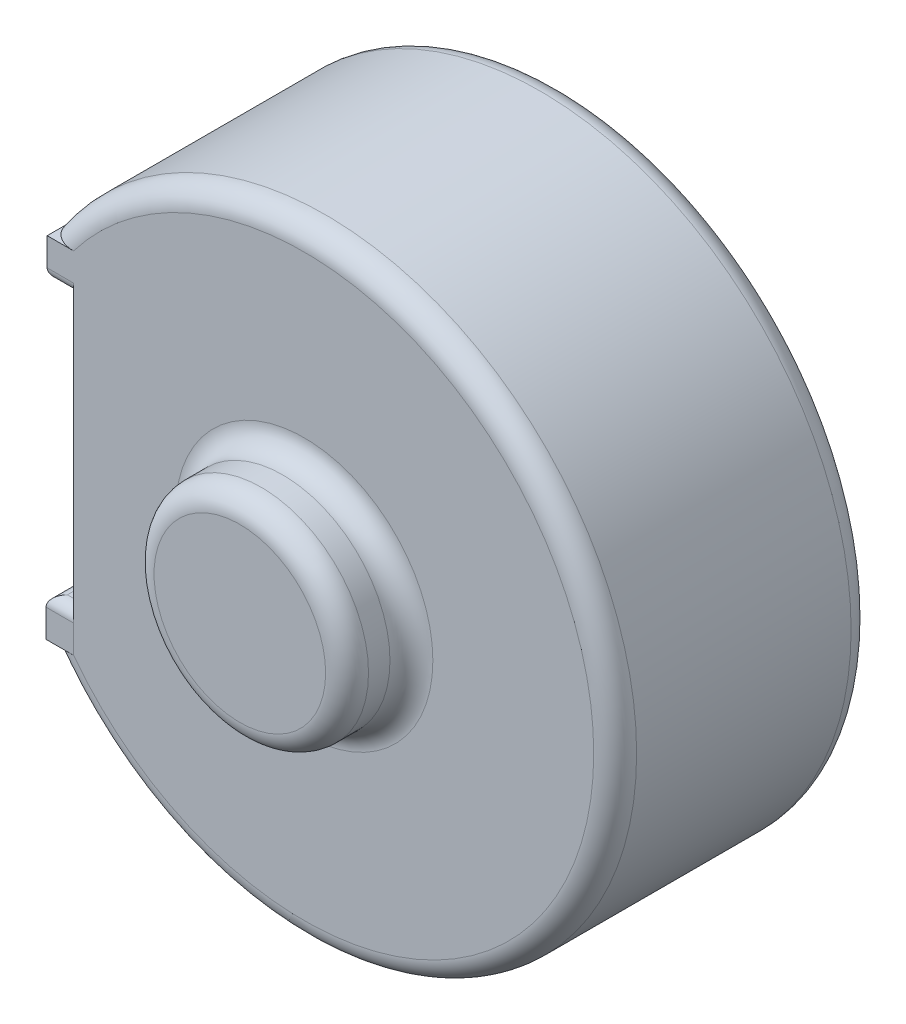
SolidWorks part; units mm, degrees
ref_plane "Front Plane" through (0, 0, 0) normal (0, 0, 1) x (1, 0, 0)
ref_plane "Top Plane" through (0, 0, 0) normal (0, 1, 0) x (1, 0, 0)
ref_plane "Right Plane" through (0, 0, 0) normal (1, 0, 0) x (0, 0, -1)
sketch "Sketch2" plane through (0, 0, 0) normal (0, 0, 1) x (1, 0, 0)
  circle A1 centre (0, 0) radius 31.75
  dimension "D2" = 63.5
extrude "Boss-Extrude1" add sketch "Sketch2" along normal blind 5.08
sketch "Sketch4" plane through (0, 0, 5.08) normal (0, 0, 1) x (1, 0, 0)
  circle A0 centre (0, 0) radius 31.75
  circle A1 centre (0, 0) radius 36.83
  dimension "D1" = 63.5
  dimension "D2" = 5.08
extrude "Boss-Extrude2" add sketch "Sketch4" against normal blind 5.08
sketch "Sketch5" plane through (0, 0, 0) normal (0, 0, -1) x (-1, 0, 0)
  circle A3 centre (0, 0) radius 36.83
  circle A4 centre (0, 0) radius 31.75
  dimension "D1" = 73.66
  dimension "D2" = 5.08
extrude "Boss-Extrude3" add sketch "Sketch5" along normal blind 25.4
sketch "Sketch6" plane through (0, 0, 0) normal (0, 0, -1) x (-1, 0, 0)
  circle A0 centre (0, 0) radius 7.874
  dimension "D1" = 15.748
extrude "Cut-Extrude1" cut sketch "Sketch6" against normal blind 25.4
fillet "Fillet1" radius 2.54 2 edges at (-31.75, 0, -25.4) (-7.874, 0, 0)
sketch "Sketch7" plane through (0, 0, 0) normal (0, 0, -1) x (-1, 0, 0)
  line L0 (0, 0) -> (54.9933, 0) construction
  line L2 (48.5498, -12.7) -> (23.1498, -12.7)
  line L3 (48.5498, -12.7) -> (48.5498, 12.7)
  line L4 (48.5498, 12.7) -> (23.1498, 12.7)
  line L5 (23.1498, -12.7) -> (23.1498, 12.7)
  line L6 (48.5498, -12.7) -> (23.1498, 12.7) construction
  line L7 (48.5498, 12.7) -> (23.1498, -12.7) construction
  point P3 (35.8498, 0)
  dimension "D1" = 25.4
  dimension "D2" = 25.4
extrude "Cut-Extrude2" cut sketch "Sketch7" along normal blind 25.4
fillet "Fillet2" radius 2.54 6 edges at (-33.2113, 12.7, -25.4) (-29.6644, 12.7, -24.3981) (-33.2113, -12.7, -25.4) (-30.0455, -12.7, -24.7732) (-29.0994, 12.7, -11.43) (-29.0994, -12.7, -11.43)
fillet "Fillet3" radius 2.54 6 edges at (-34.5711, 12.7, -11.43) (-34.2472, 13.5491, -24.7554) (36.83, 0, -25.4) (-34.3842, -13.1975, -24.3698) (-34.5711, -12.7, -11.43) (-36.83, 0, 0)
fillet "Fillet4" radius 2.54 1 edges at (36.83, 0, 5.08)
sketch "Sketch8" plane through (0, 0, 5.08) normal (0, 0, 1) x (1, 0, 0)
  line L0 (0, 0) -> (-39.5483, 0) construction
  line L2 (-46.355, -20.7423) -> (-27.305, -20.7423)
  line L3 (-46.355, -20.7423) -> (-46.355, 20.7423)
  line L4 (-46.355, 20.7423) -> (-27.305, 20.7423)
  line L5 (-27.305, -20.7423) -> (-27.305, 20.7423)
  line L6 (-46.355, -20.7423) -> (-27.305, 20.7423) construction
  line L7 (-46.355, 20.7423) -> (-27.305, -20.7423) construction
  arc A0 (-32.9926, 16.3689) -> (-32.9926, -16.3689) centre (0, 0) ccw construction
  circle A1 centre (0, 0) radius 34.29 construction
  point P3 (-36.83, 0)
  dimension "D1" = 19.05
extrude "Cut-Extrude3" cut sketch "Sketch8" against normal through all
sketch "Sketch10" plane through (0, 20.7423, 0) normal (0, -1, 0) x (1, 0, 0)
  line L1 (-27.305, 5.08) -> (-30.4337, 5.08)
  line L2 (-27.305, 5.08) -> (-27.305, -25.4)
  line L3 (-27.305, -25.4) -> (-30.4337, -25.4)
  line L4 (-30.4337, 5.08) -> (-30.4337, -25.4)
  dimension "D1" = 3.1287
extrude "Boss-Extrude4" add sketch "Sketch10" along normal blind 4.572
sketch "Sketch11" plane through (0, -20.7423, 0) normal (0, 1, 0) x (1, 0, 0)
  line L1 (-27.305, 25.4) -> (-30.5858, 25.4)
  line L2 (-27.305, 25.4) -> (-27.305, -5.0674)
  line L3 (-27.305, -5.0674) -> (-30.5858, -5.0674)
  line L4 (-30.5858, 25.4) -> (-30.5858, -5.0674)
  dimension "D1" = 30.4674
  dimension "D2" = 3.2808
extrude "Boss-Extrude5" add sketch "Sketch11" along normal blind 4.572
sketch "Sketch12" plane through (0, 0, 5.08) normal (0, 0, 1) x (1, 0, 0)
  circle A0 centre (0, 0) radius 8.89
  circle A1 centre (0, 0) radius 12.7
  dimension "D1" = 3.81
  dimension "D2" = 17.78
extrude "Boss-Extrude6" add sketch "Sketch12" along normal blind 5.08
sketch "Sketch13" plane through (0, 0, 10.16) normal (0, 0, 1) x (1, 0, 0)
  circle A0 centre (0, 0) radius 12.7
extrude "Boss-Extrude7" add sketch "Sketch13" along normal blind 2.54
fillet "Fillet5" radius 2.54 1 edges at (12.7, 0, 5.08)
fillet "Fillet6" radius 2.54 1 edges at (12.7, 0, 12.7)
fillet "Fillet7" radius 1.27 1 edges at (-27.305, 0, 0)
fillet "Fillet8" radius 1.27 6 edges at (-27.305, -16.1703, -12.7) (-27.305, 16.1703, -12.7) (-28.8693, 16.1703, 5.08) (-30.4337, 16.1703, -10.16) (-28.9454, -16.1703, 5.0674) (-30.5858, -16.1703, -10.1663)
